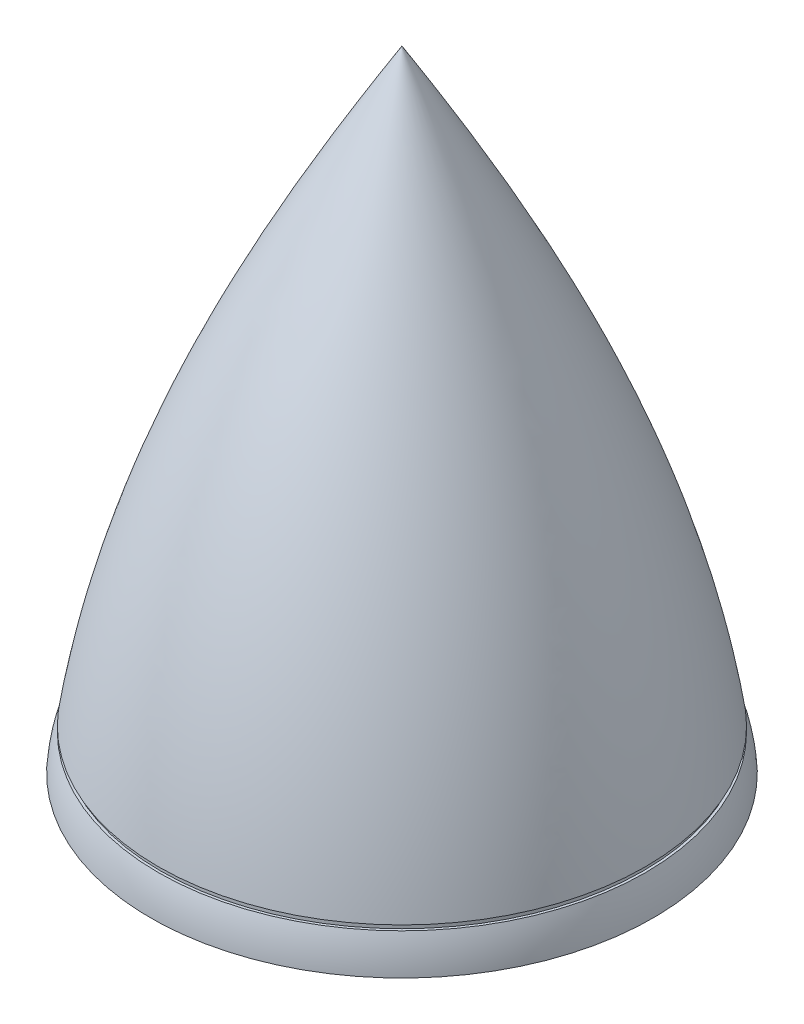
SolidWorks part; units mm, degrees
ref_plane "前视基准面" through (0, 0, 0) normal (0, 0, 1) x (1, 0, 0)
ref_plane "上视基准面" through (0, 0, 0) normal (0, 1, 0) x (1, 0, 0)
ref_plane "右视基准面" through (0, 0, 0) normal (1, 0, 0) x (0, 0, -1)
other "Configuration Table"
sketch "草图1" plane through (0, 0, 0) normal (0, 0, 1) x (1, 0, 0)
  line L0 (0, 0) -> (480, 0)
  line L1 (0, 0) -> (0, 1160)
  spline S0 degree 3 poles (0, 1160) (214.6507, 803.6896) (416.5333, 416.9797) (480, 0) knots 0 0 0 0 1 1 1 1
  dimension "D3" = 520
  dimension "D1" = 480
  dimension "D2" = 1160
  dimension "D4" = 280
revolve "旋转1" add sketch "草图1" angle 360 about L1
sketch "草图5" plane through (0, 0, 0) normal (0, 0, 1) x (1, 0, 0)
  line L0 (-495, -80) -> (-490, -80)
  line L1 (-480, 0) -> (480, 0) construction
  line L2 (-475, 0) -> (-475, -10)
  line L7 (-460, -20) -> (-440, -20)
  line L9 (-424.1509, -83) -> (-419.3172, -83)
  line L11 (-390, -20) -> (-375, -20)
  line L13 (-330, -78) -> (-300, -78)
  line L14 (-300, -78) -> (-275, -20)
  line L15 (-275, -20) -> (-260, -20)
  line L17 (-210, -40) -> (-200, -40)
  line L18 (-200, -40) -> (-200, -10)
  line L19 (-200, -10) -> (0, -10)
  line L22 (0, -10) -> (0, 0)
  line L23 (0, 0) -> (-475, 0)
  line L24 (-475, -10) -> (-480, -10)
  line L25 (-490, -80) -> (-487, -70)
  line L26 (-487, -70) -> (-460, -20)
  spline S0 degree 2 poles (-480, -10) (-492.4879, -43.9081) (-495, -80) knots 0 0 0 1 1 1
  spline S1 degree 2 poles (-440, -20) (-438.1446, -53.1306) (-424.1509, -83) knots 0 0 0 1 1 1
  spline S2 degree 2 poles (-419.3172, -83) (-407.3465, -50.2526) (-390, -20) knots 0 0 0 1 1 1
  spline S3 degree 2 poles (-375, -20) (-359.9505, -55.2701) (-330, -78) knots 0 0 0 1 1 1
  spline S4 degree 2 poles (-260, -20) (-240.344, -39.2271) (-210, -40) knots 0 0 0 1 1 1
  point P1 (0, -5)
  dimension "D1" = 80
  dimension "D2" = 5
  dimension "D3" = 475
  dimension "D4" = 10
  dimension "D5" = 5
  dimension "D6" = 3
  dimension "D7" = 30
  dimension "D8" = 70
  dimension "D9" = 495
  dimension "D10" = 20
  dimension "D11" = 20
  dimension "D12" = 83
  dimension "D13" = 20
  dimension "D14" = 15
  dimension "D15" = 78
  dimension "D16" = 20
  dimension "D17" = 15
  dimension "D18" = 200
  dimension "D19" = 260
  dimension "D20" = 210
  dimension "D21" = 40
  dimension "D22" = 300
  dimension "D23" = 30
  dimension "D24" = 375
  dimension "D25" = 200
  dimension "D26" = 30
revolve "旋转2" add sketch "草图5" angle 360 about L22
